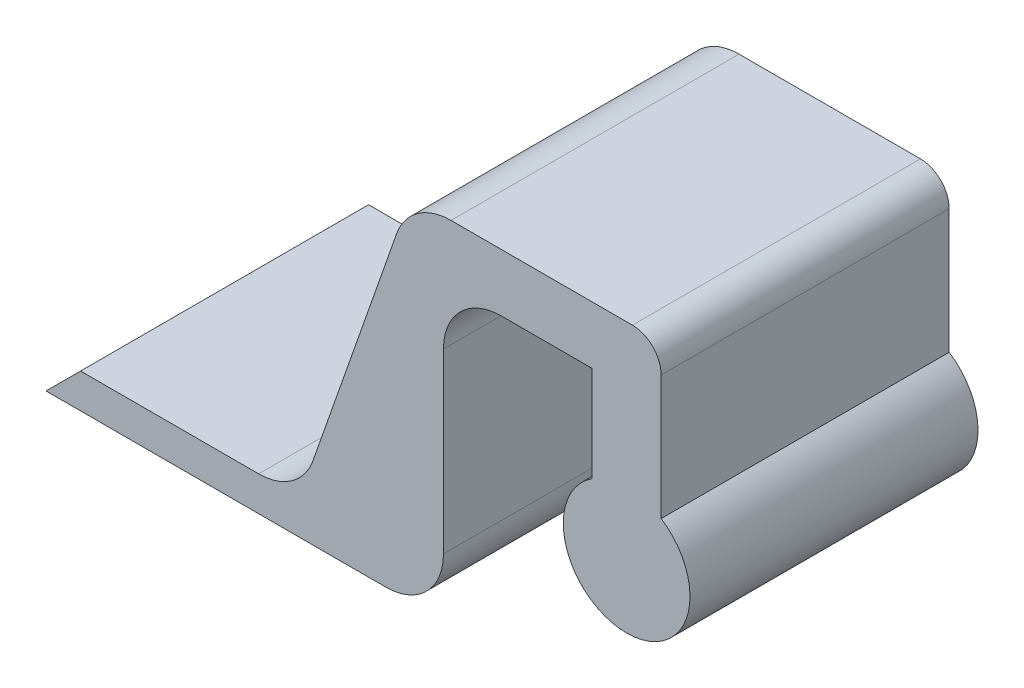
SolidWorks part; units mm, degrees
ref_plane "Front Plane" through (0, 0, 0) normal (0, 0, 1) x (1, 0, 0)
ref_plane "Top Plane" through (0, 0, 0) normal (0, 1, 0) x (1, 0, 0)
ref_plane "Right Plane" through (0, 0, 0) normal (1, 0, 0) x (0, 0, -1)
sketch "Sketch1" plane through (0, 0, 0) normal (0, 0, 1) x (1, 0, 0)
  line L0 (-3, 4.6098) -> (-3, 12.9)
  line L1 (-3, 8.7549) -> (3, 8.7549) construction
  line L2 (3, 12.9) -> (3, 4.6098)
  line L3 (-3, 12.9) -> (-15.9, 12.9)
  line L4 (-28.4, -9.5) -> (-18.7868, 17.9)
  line L5 (-15.9, -12.5) -> (-50.4, -12.5)
  line L6 (-50.4, -12.5) -> (-47.4, -9.5)
  line L7 (-47.4, -9.5) -> (-28.4, -9.5)
  line L8 (-15.9, 12.9) -> (-15.9, -12.5)
  line L9 (-18.7868, 17.9) -> (3, 17.9)
  line L10 (3, 17.9) -> (3, 12.9)
  line L11 (-15.9, 12.9) -> (-18.7868, 17.9) construction
  circle A0 centre (0, 0) radius 5.5
  point P9 (0, 8.7549)
  dimension "D1" = 11
  dimension "D2" = 6
  dimension "D3" = 12.9
  dimension "D4" = 25.4
  dimension "D5" = 12.9
  dimension "D6" = 19
  dimension "D7" = 5
  dimension "D8" = 70.667
  dimension "D9" = 34.5
  dimension "D10" = 45
  dimension "D11" = 27.4
  dimension "D12" = 29.0375
extrude "Boss-Extrude1" add sketch "Sketch1" along normal blind 25
fillet "Fillet6" radius 5 1 edges at (-28.4, -9.5, 12.5)
fillet "Fillet2" radius 5 1 edges at (-15.9, -12.5, 12.5)
fillet "Fillet3" radius 5 1 edges at (-18.7868, 17.9, 12.5)
fillet "Fillet4" radius 2.5 1 edges at (3, 17.9, 12.5)
fillet "Fillet5" radius 5 1 edges at (-15.9, 12.9, 12.5)
